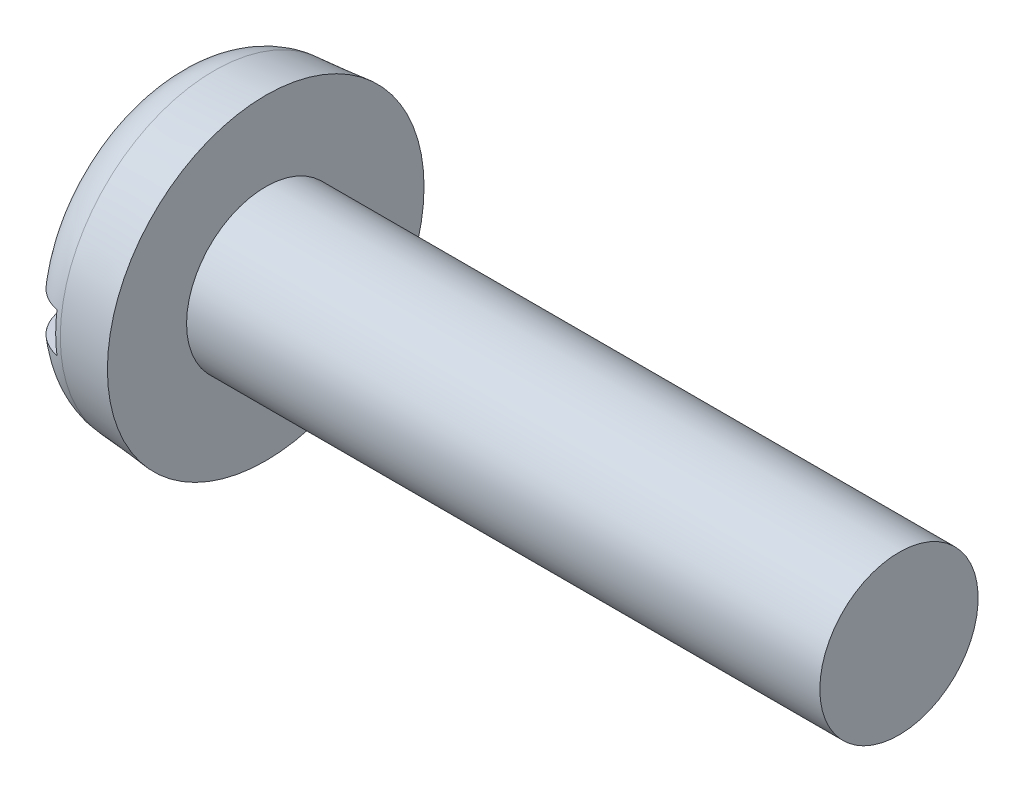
SolidWorks part; units mm, degrees
ref_plane "Plane1" through (0, 0, 0) normal (0, 0, 1) x (1, 0, 0)
ref_plane "Plane2" through (0, 0, 0) normal (0, 1, 0) x (1, 0, 0)
ref_plane "Plane3" through (0, 0, 0) normal (1, 0, 0) x (0, 0, -1)
sketch "BodySke" plane through (0, 0, 0) normal (0, 0, 1) x (1, 0, 0)
  line L0 (6, 5) -> (6, 10)
  line L1 (0, 0) -> (0, 9.4751)
  line L2 (-25.4, 0) -> (127, 0) construction
  line L3 (46, 0) -> (0, 0)
  line L4 (6, 5) -> (46, 5)
  line L5 (46, 5) -> (46, 0)
  line L6 (0, 9.4751) -> (6, 10)
  line L9 (7.5, 6.5875) -> (7.5, -2.9375) construction
  line L10 (6, 6.35) -> (6, -3.175) construction
  dimension "Head_ht" = 6
  dimension "Diameter" = 10
  dimension "Length" = 40
  dimension "Head_dia" = 20
  dimension "Advance" = 1.5
  dimension "Thread_nom" = 40
  dimension "Head_side_angle" = 5
revolve "Base-Revolve" add sketch "BodySke"
fillet "Fillet1" [suppressed] radius 0.4
fillet "Fillet2" radius 3 1 edges at (0, 0, 9.4751)
sketch "Sketch2" plane through (0, 0, 0) normal (1, 0, 0) x (0, 0, -1)
  line L0 (10, -1.25) -> (-10, -1.25)
  line L1 (10, -1.25) -> (10, 1.25)
  line L2 (-10, 1.25) -> (10, 1.25)
  line L3 (-10, 1.25) -> (-10, -1.25)
  dimension "D1" = 20
  dimension "D2" = 10
  dimension "Slot_width" = 2.5
  dimension "D3" = 1.25
extrude "Slot" cut sketch "Sketch2" along normal blind 2.4
sketch "ThdSchSke" plane through (0, 0, 0) normal (0, 0, 1) x (1, 0, 0)
  line L0 (9, -4.1885) -> (8.4318, -5)
  line L1 (9, -4.1885) -> (9.5682, -5)
  line L2 (9.5682, -5) -> (9.5682, -6.25)
  line L3 (-3.175, 0) -> (5.1513, 0) construction
  line L5 (9.5682, -6.25) -> (8.4318, -6.25)
  line L6 (8.4318, -6.25) -> (8.4318, -5)
  dimension "Thread_minor" = 8.377
  dimension "Diameter" = 10
  dimension "Start" = 9
  dimension "SideAngle" = 55
  dimension "VeeAngle" = 70
  dimension "Overcut" = 12.5
revolve "ThreadSchematic" [suppressed] cut sketch "ThdSchSke" angle 360 about L3
pattern_linear "ThdSchPat" [suppressed]
equation "\"D1@Sketch2\" = \"Head_dia@BodySke\""
equation "\"D2@Sketch2\" = \"D1@Sketch2\" / 2"
equation "\"D3@Sketch2\" = \"Slot_width@Sketch2\" / 2"
equation "\"Thread_length@ThreadCosmetic\" = ((sgn( (\"Length@BodySke\" - \"Advance@BodySke\" * 2.0 ) - \"Thread_nom@BodySke\" )-1)*( (\"Length@BodySke\" - \"Advance@BodySke\"  * 2.0) - \"Thread_nom@BodySke\" ))/-2+ \"Thread_"
equation "\"Thread_minor@ThdSchSke\" = \"Thread_minor@ThreadCosmetic\""
equation "\"Diameter@ThdSchSke\" = \"Diameter@BodySke\""
equation "\"Overcut@ThdSchSke\" = \"Diameter@BodySke\" * 1.25"
equation "\"Start@ThdSchSke\" = \"Head_ht@BodySke\" + \"Length@BodySke\" - \"Thread_length@ThreadCosmetic\"  '---Non-countersunk---"
equation "\"Num_threads@ThdSchPat\" = int( \"Thread_length@ThreadCosmetic\" / \"Advance@BodySke\" + 0.999 )  + 1"
equation "\"Advance@ThdSchPat\" = \"Thread_length@ThreadCosmetic\" /  (\"Num_threads@ThdSchPat\" - 1) 'relax it"
